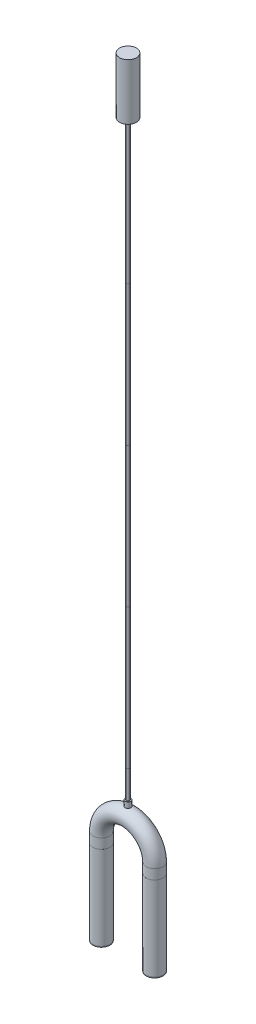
SolidWorks part; units mm, degrees
ref_plane "Alzado" through (0, 0, 0) normal (0, 0, 1) x (1, 0, 0)
ref_plane "Planta" through (0, 0, 0) normal (0, 1, 0) x (1, 0, 0)
ref_plane "Vista lateral" through (0, 0, 0) normal (1, 0, 0) x (0, 0, -1)
sketch "Croquis1" plane through (0, 0, 0) normal (0, 0, 1) x (1, 0, 0)
  line L0 (-95, 0) -> (95, 0) construction
  line L1 (-95, 0) -> (-95, 35)
  line L2 (-120, 130) -> (120, 130) construction
  line L3 (95, 35) -> (95, 0)
  arc A0 (95, 35) -> (-95, 35) centre (0, 35) ccw
  point P4 (0, 0)
  dimension "D1" = 130
  dimension "D2" = 190
sweep "Barrer1" add path "Croquis1" parameters "D3"=60
shell "Vaciado1" thickness 3
ref_plane "Plano1" through (0, 160, 0) normal (0, 1, 0) x (1, 0, 0)
sketch "Croquis40" plane through (0, 160, 0) normal (0, 1, 0) x (1, 0, 0)
  circle A0 centre (0, 0) radius 10
  dimension "D1" = 20
extrude "Saliente-Extruir3" add sketch "Croquis40" along normal blind 20 separate body
sketch "Croquis41" plane through (0, 180, 0) normal (0, 1, 0) x (1, 0, 0)
  circle A0 centre (0, 0) radius 6
  dimension "D1" = 12
extrude "Saliente-Extruir4" add sketch "Croquis41" along normal blind 100 separate body
sketch "Croquis70" plane through (0, 280, 0) normal (0, 1, 0) x (1, 0, 0)
  circle A1 centre (0, 0) radius 6
  circle A2 centre (0, 0) radius 6
  dimension "D1" = 0
extrude "Saliente-Extruir9" add sketch "Croquis70" along normal blind 500 separate body
sketch "Croquis71" plane through (0, 780, 0) normal (0, 1, 0) x (1, 0, 0)
  circle A1 centre (0, 0) radius 6
  circle A2 centre (0, 0) radius 6
  dimension "D1" = 0
extrude "Saliente-Extruir10" add sketch "Croquis71" along normal blind 500 separate body
sketch "Croquis72" plane through (0, 1280, 0) normal (0, 1, 0) x (1, 0, 0)
  circle A1 centre (0, 0) radius 6
  circle A2 centre (0, 0) radius 6
  dimension "D1" = 0
extrude "Saliente-Extruir11" add sketch "Croquis72" along normal blind 500 separate body
sketch "Croquis73" plane through (0, 1780, 0) normal (0, 1, 0) x (1, 0, 0)
  circle A1 centre (0, 0) radius 6
  circle A2 centre (0, 0) radius 6
  dimension "D1" = 0
extrude "Saliente-Extruir12" add sketch "Croquis73" along normal blind 500 separate body
sketch "Croquis42" plane through (0, 0, 0) normal (0, -1, 0) x (1, 0, 0)
  circle A0 centre (-95, 0) radius 27 construction
  circle A1 centre (95, 0) radius 30
  circle A2 centre (95, 0) radius 30
  circle A3 centre (-95, 0) radius 30
  circle A4 centre (-95, 0) radius 30
  circle A5 centre (95, 0) radius 27 construction
  circle A6 centre (-95, 0) radius 27
  circle A7 centre (95, 0) radius 27
  dimension "D1" = 0
  dimension "D2" = 0
extrude "Saliente-Extruir5" add sketch "Croquis42" along normal blind 300 separate body
sketch "Croquis43" plane through (0, -300, 0) normal (0, -1, 0) x (1, 0, 0)
  circle A0 centre (-95, 0) radius 30 construction
  circle A1 centre (95, 0) radius 30 construction
  circle A2 centre (-95, 0) radius 30
  circle A3 centre (95, 0) radius 30
extrude "Saliente-Extruir6" add sketch "Croquis43" along normal blind 3 separate body
sketch "Croquis68" plane through (0, 2280, 0) normal (0, 1, 0) x (1, 0, 0)
  circle A0 centre (0, 0) radius 7.5
  dimension "D1" = 15
extrude "Saliente-Extruir7" add sketch "Croquis68" along normal blind 10 separate body
sketch "Croquis69" plane through (0, 2290, 0) normal (0, 1, 0) x (1, 0, 0)
  circle A0 centre (0, 0) radius 30
  dimension "D1" = 60
extrude "Saliente-Extruir8" add sketch "Croquis69" along normal blind 200 separate body
